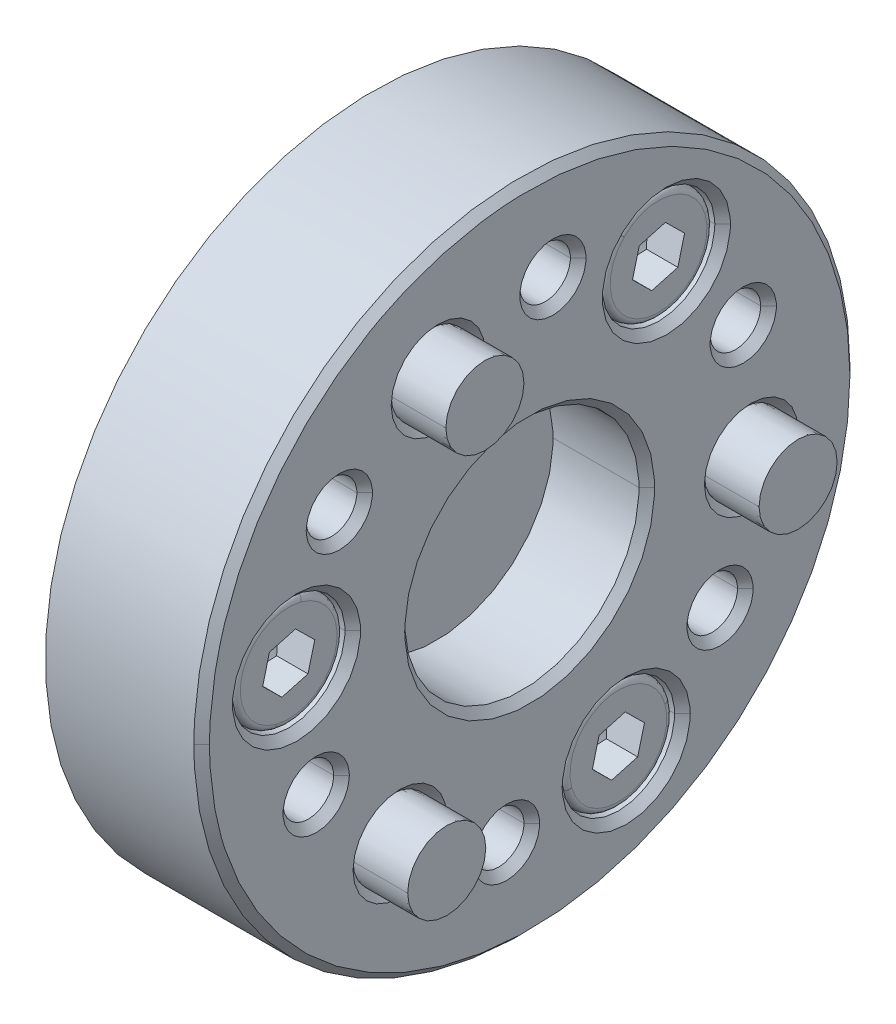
SolidWorks part; units mm, degrees
ref_plane "Alzado" through (0, 0, 0) normal (0, 0, 1) x (1, 0, 0)
ref_plane "Planta" through (0, 0, 0) normal (0, 1, 0) x (1, 0, 0)
ref_plane "Vista lateral" through (0, 0, 0) normal (1, 0, 0) x (0, 0, -1)
imported_body "GIM8108-48刹车安装尺寸图_25072201.STEP.step<1>"
sketch "Croquis3" plane through (-78.1843, 0, 0) normal (-1, 0, 0) x (0, 0, 1)
  line L1 (-28.65, 28.65) -> (28.65, 28.65)
  line L2 (-28.65, 28.65) -> (-28.65, -28.65)
  line L3 (-28.65, -28.65) -> (28.65, -28.65)
  line L4 (28.65, 28.65) -> (28.65, -28.65)
  line L5 (-28.65, 28.65) -> (28.65, -28.65) construction
  line L6 (-28.65, -28.65) -> (28.65, 28.65) construction
  point P0 (0, 0)
  dimension "D1" = 57.3
  dimension "D2" = 57.3
extrude "Cortar-Extruir3" cut sketch "Croquis3" against normal blind 25.1
sketch "Croquis4" plane through (-53.0843, 0, 0) normal (-1, 0, 0) x (0, 0, 1)
  circle A0 centre (0, 0) radius 28.5
  dimension "D1" = 57
extrude "Saliente-Extruir1" add sketch "Croquis4" along normal blind 11
sketch "Croquis5" plane through (-64.0843, 0, 0) normal (-1, 0, 0) x (0, 0, 1)
  line L0 (-22.6549, -17.2917) -> (2.3561, -28.4024)
  line L1 (15.6248, 45.5821) -> (23.349, 42.1507) construction
  circle A0 centre (0, 0) radius 28.5 construction
  circle A1 centre (0, 0) radius 28.5 construction
  arc A2 (-22.6549, -17.2917) -> (2.3561, -28.4024) centre (0, 0) ccw
  dimension "D1" = 53.5
extrude "Cortar-Extruir4" cut sketch "Croquis5" against normal blind 11
chamfer "Chaflán1" distance 1 angle 45 1 edges at (-64.0843, 26.0457, 11.5703)
sketch "Sketch1" plane through (4.4157, 0, 0) normal (1, 0, 0) x (0, 0, -1)
  line L1 (-48.4852, 48.7352) -> (48.4852, 48.7352)
  line L2 (-48.4852, 48.7352) -> (-48.4852, -48.7352)
  line L3 (-48.4852, -48.7352) -> (48.4852, -48.7352)
  line L4 (48.4852, 48.7352) -> (48.4852, -48.7352)
  line L5 (-48.4852, 48.7352) -> (48.4852, -48.7352) construction
  line L6 (-48.4852, -48.7352) -> (48.4852, 48.7352) construction
  circle A0 centre (0, 0) radius 21
  arc A1 (-21, 0) -> (21, 0) centre (0, 0) ccw construction
  arc A2 (46.9509, -1.1401) -> (46.8328, 3.5178) centre (45.9852, 1.1659) ccw construction
  arc A3 (1.1659, -48.7352) -> (3.9151, -46.0532) centre (1.1659, -45.9852) ccw construction
extrude "Cut-Extrude1" cut sketch "Sketch1" against normal through all
sketch "Sketch2" plane through (-64.0843, 0, 0) normal (-1, 0, 0) x (0, 0, 1)
  circle A0 centre (0, 0) radius 21
  circle A1 centre (0, 0) radius 21 construction
extrude "Cut-Extrude2" cut sketch "Sketch2" against normal offset from surface (58.5 mm away) 10
